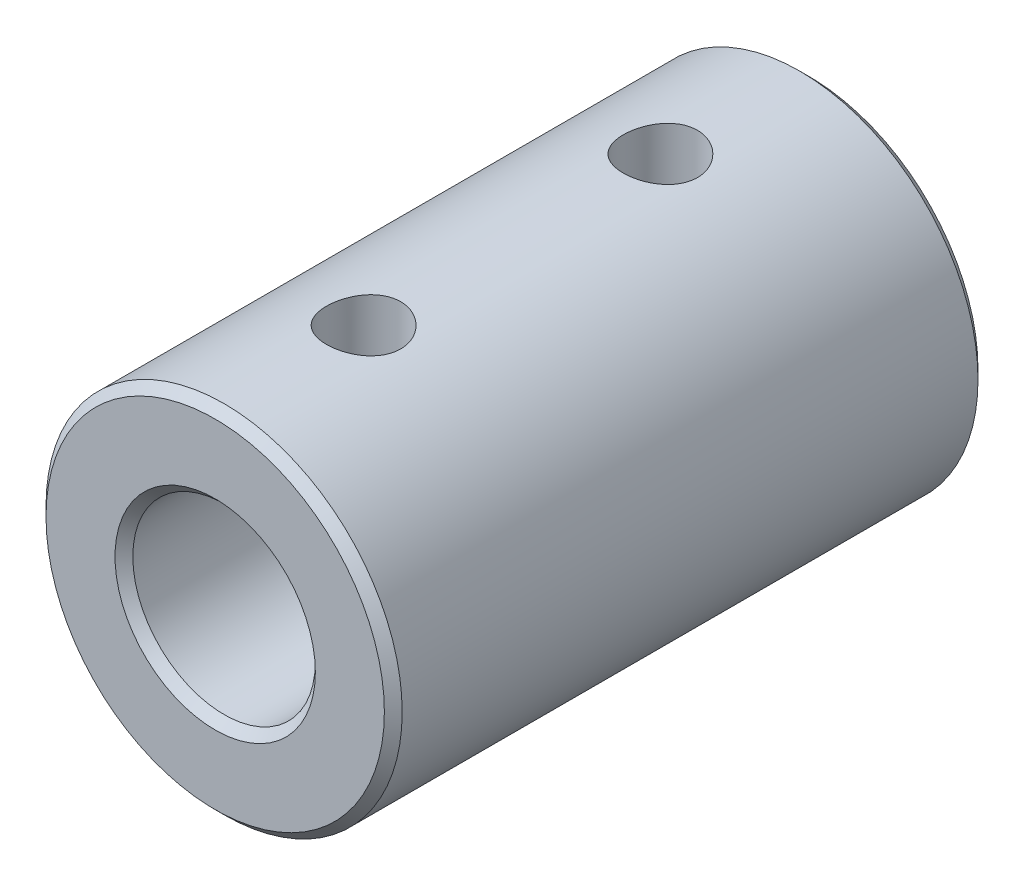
SolidWorks part; units mm, degrees
ref_plane "Plan de face" through (0, 0, 0) normal (0, 0, 1) x (1, 0, 0)
ref_plane "Plan de dessus" through (0, 0, 0) normal (0, 1, 0) x (1, 0, 0)
ref_plane "Plan de droite" through (0, 0, 0) normal (1, 0, 0) x (0, 0, -1)
sketch "Esquisse1" plane through (0, 0, 0) normal (0, 0, 1) x (1, 0, 0)
  circle A0 centre (0, 0) radius 6
  circle A1 centre (0, 0) radius 3.075
extrude "Boss.-Extru.1" add sketch "Esquisse1" along normal mid plane 20
ref_plane "Plan1" through (0, 0, 0) normal (0, 1, 0) x (-1, 0, 0)
sketch "Esquisse3" plane through (0, 0, 0) normal (0, 1, 0) x (-1, 0, 0)
  line L0 (0, -2.4446) -> (0, 9.3829) construction
  line L1 (-5.1223, 0) -> (1.4849, 0) construction
  line L2 (-5.1223, 5) -> (1.4849, 5) construction
  circle A0 centre (0, 5) radius 1.25
  circle A1 centre (0, -5) radius 1.25
  dimension "D1" = 5
extrude "Enlèv. mat.-Extru.2" cut sketch "Esquisse3" against normal mid plane 12
chamfer "Chanfrein1" distance 0.3 angle 45 4 edges at (3.075, 0, -10) (6, 0, -10) (6, 0, 10) (3.075, 0, 10)
